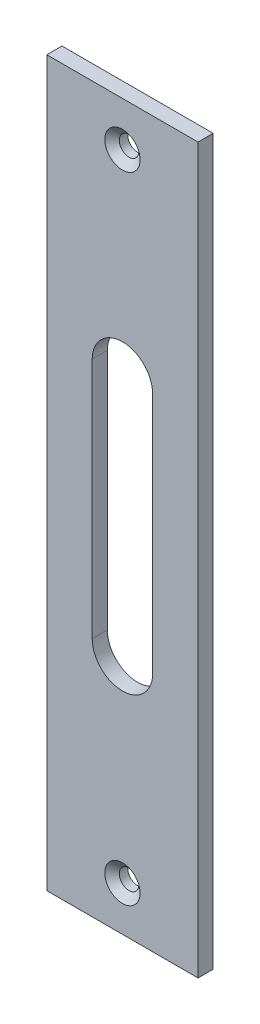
SolidWorks part; units mm, degrees
ref_plane "Plane1" through (0, 0, 0) normal (0, 0, 1) x (1, 0, 0)
ref_plane "Plane2" through (0, 0, 0) normal (0, 1, 0) x (1, 0, 0)
ref_plane "Plane3" through (0, 0, 0) normal (1, 0, 0) x (0, 0, -1)
sketch "Sketch1" plane through (0, 0, 0) normal (0, 0, 1) x (1, 0, 0)
  line L30 (7.9375, 38) -> (-7.9375, 38)
  line L31 (7.9375, 38) -> (-7.9375, 38)
  line L50 (7.9375, 38.1) -> (7.9375, 12.813) construction
  line L51 (-7.9375, -38) -> (7.9375, -38)
  line L52 (-7.9375, -38) -> (7.9375, -38)
  line L53 (-7.9375, 12.813) -> (-7.9375, 38.1) construction
  line L54 (7.9375, 38) -> (7.9375, -38)
  line L55 (-7.9375, -38) -> (-7.9375, 38)
  dimension "D1" = 0.1
  dimension "D2" = 0.1
extrude "Extrude1" add sketch "Sketch1" along normal up to vertex (1.5875 mm away)
sketch "Sketch2" plane through (0, 0, 1.5875) normal (0, 0, 1) x (1, 0, 0)
  line L0 (0, 0) -> (0, 38) construction
  line L1 (-3.175, -12.7) -> (-3.175, 12.7)
  line L2 (3.175, -12.7) -> (3.175, 12.7)
  line L3 (7.9375, 0) -> (-7.9375, 0) construction
  line L5 (-7.9375, 38) -> (-7.9375, -38) construction
  line L6 (7.9375, 38) -> (-7.9375, 38) construction
  arc A0 (-3.175, 12.7) -> (3.175, 12.7) centre (0, 12.7) cw
  arc A1 (-3.175, -12.7) -> (3.175, -12.7) centre (0, -12.7) ccw
  dimension "D1" = 6.35
  dimension "D2" = 25.4
extrude "Cut-Extrude1" cut sketch "Sketch2" against normal through all
hole_wizard "CSK for #1 Flat Head Machine Screw (100)2" positions "Sketch5" profile "Sketch4" countersink size "#1" standard "Ansi Inch"
sketch "Sketch5" plane through (0, 0, 1.5875) normal (0, 0, 1) x (1, 0, 0)
  point P0 (0, 33.3375)
  point P6 (0, -33.3375)
sketch "Sketch4" plane through (0, 33.3375, 1.5875) normal (1, 0, 0) x (0, -1, 0)
  line L0 (0, 0) -> (0, 26.0181)
  line L1 (0, 26.0181) -> (1.0287, 25.4)
  line L2 (1.0287, 25.4) -> (1.0287, 0.6927)
  line L3 (1.0287, 0.6927) -> (1.8542, 0)
  line L5 (1.8542, 0) -> (0, 0)
  line L6 (-1.0287, 0.6927) -> (-1.8542, 0) construction
  line L10 (0, 26.0181) -> (-1.0287, 25.4) construction
  line L11 (0, -6.35) -> (0, 107.95) construction
  dimension "Hole Dia." = 2.0574
  dimension "Hole Depth" = 25.4
  dimension "Near C'Sink Dia." = 3.7084
  dimension "Near C'Sink Angle" = 100
  dimension "Drill Angle" = 118
